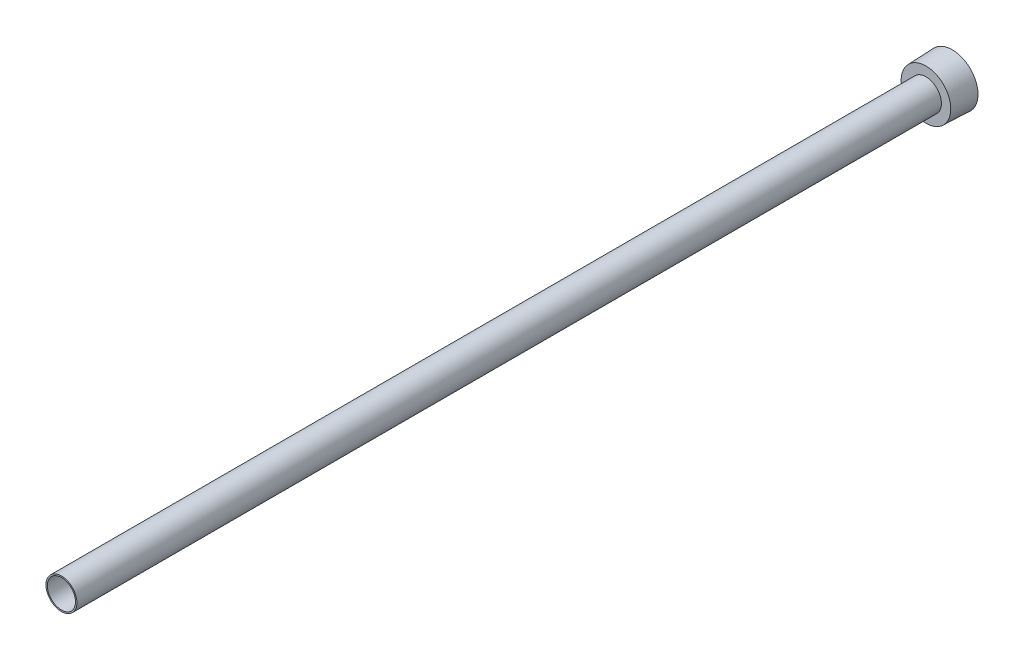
SolidWorks part; units mm, degrees
ref_plane "Front Plane" through (0, 0, 0) normal (0, 0, 1) x (1, 0, 0)
ref_plane "Top Plane" through (0, 0, 0) normal (0, 1, 0) x (1, 0, 0)
ref_plane "Right Plane" through (0, 0, 0) normal (1, 0, 0) x (0, 0, -1)
sketch "Sketch1" plane through (0, 0, 0) normal (1, 0, 0) x (0, 0, -1)
  line L0 (-278.0011, 0) -> (49721.9989, 0) construction
  line L1 (-457.2, 0) -> (0, 0)
  line L6 (0, 0) -> (0, 13.2207)
  line L7 (0, 13.2207) -> (-13.4874, 12.7287)
  line L8 (-13.4874, 12.7287) -> (-13.4874, 7.9375)
  line L9 (-13.4874, 7.9375) -> (-457.2, 7.9375)
  line L10 (-457.2, 7.9375) -> (-457.2, 0)
  dimension "D1" = 13.4874
  dimension "D2" = 26.4414
  dimension "D3" = 2.089
  dimension "D4" = 15.875
  dimension "D5" = 457.2
revolve "Revolve1" add sketch "Sketch1" angle 360 about L0
sketch "Sketch2" plane through (0, 0, 457.2) normal (0, 0, 1) x (1, 0, 0)
  circle A0 centre (0, 0) radius 7.2263
  dimension "D1" = 14.4526
extrude "Cut-Extrude1" cut sketch "Sketch2" against normal through all
sketch "Sketch3" plane through (0, 0, 0) normal (0, 0, -1) x (-1, 0, 0)
  line L0 (0, 14.5428) -> (0, -14.5428) construction
  line L1 (-9.525, -5.4993) -> (0, -10.9985)
  line L2 (0, -10.9985) -> (9.525, -5.4993)
  line L3 (9.525, -5.4993) -> (9.525, 5.4993)
  line L4 (9.525, 5.4993) -> (0, 10.9985)
  line L5 (0, 10.9985) -> (-9.525, 5.4993)
  line L6 (-9.525, 5.4993) -> (-9.525, -5.4993)
  circle A0 centre (0, 0) radius 9.525 construction
  dimension "D1" = 19.05
extrude "Cut-Extrude2" cut sketch "Sketch3" against normal blind 9.525
